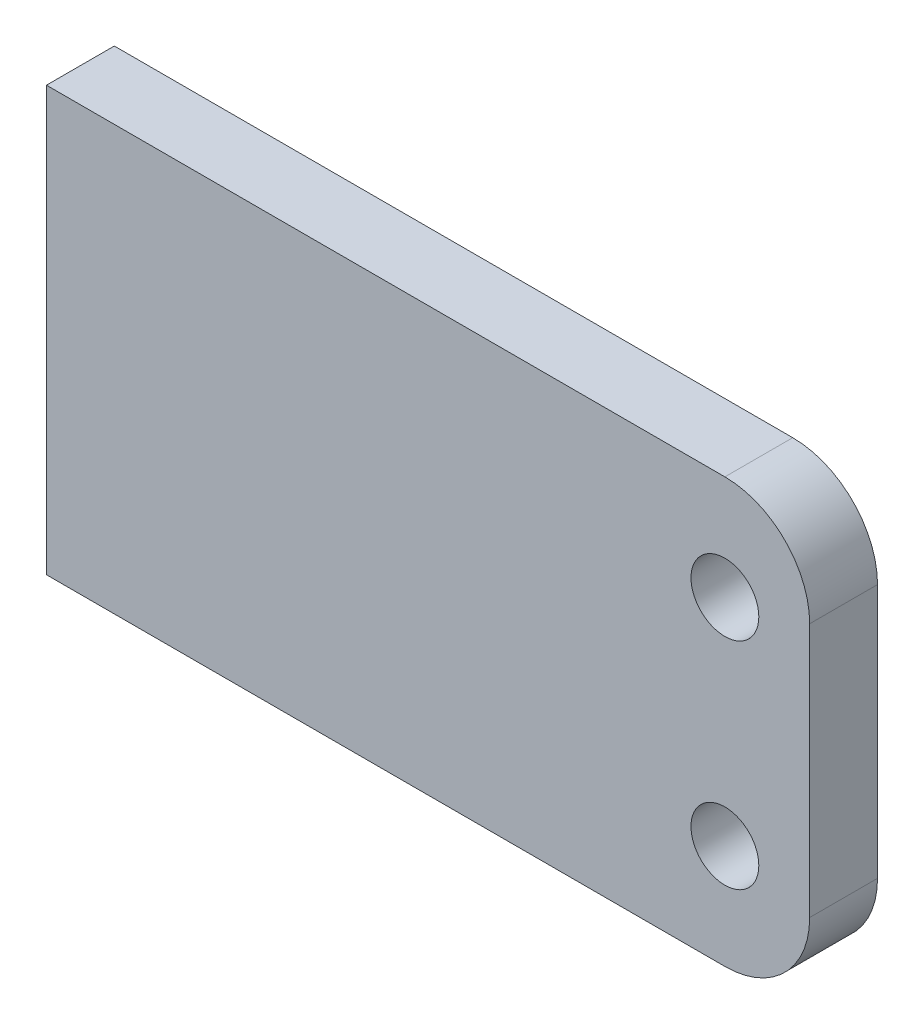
SolidWorks part; units mm, degrees
ref_plane "Face" through (0, 0, 0) normal (0, 0, 1) x (1, 0, 0)
ref_plane "Dessus" through (0, 0, 0) normal (0, 1, 0) x (1, 0, 0)
ref_plane "Droite" through (0, 0, 0) normal (1, 0, 0) x (0, 0, -1)
sketch "Esquisse1" plane through (0, 0, 0) normal (0, 0, 1) x (1, 0, 0)
  line L1 (0, 0) -> (80, 0)
  line L2 (0, 0) -> (0, -50)
  line L3 (0, -50) -> (80, -50)
  line L4 (90, -10) -> (90, -40)
  circle A0 centre (80, -12.3) radius 4
  circle A1 centre (80, -37.7) radius 4
  arc A2 (90, -10) -> (80, 0) centre (80, -10) ccw
  arc A3 (80, -50) -> (90, -40) centre (80, -40) ccw
  point P11 (90, 0)
  dimension "D3" = 8
  dimension "D7" = 10
  dimension "D1" = 90
  dimension "D2" = 50
  dimension "D4" = 10
  dimension "D5" = 25.4
  dimension "D6" = 12.3
extrude "Base-Extrusion" add sketch "Esquisse1" along normal blind 8
